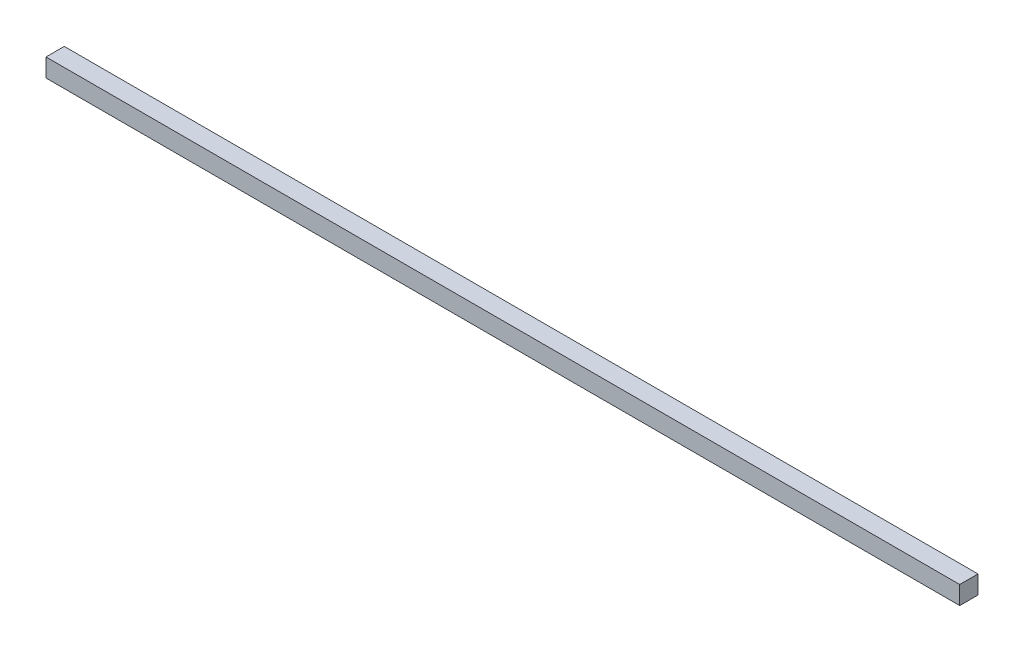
SolidWorks part; units mm, degrees
ref_plane "正面" through (0, 0, 0) normal (1, 0, 0) x (0, 1, 0)
ref_plane "平面" through (0, 0, 0) normal (0, 0, 1) x (0, 1, 0)
ref_plane "右側面" through (0, 0, 0) normal (0, 1, 0) x (-1, 0, 0)
sketch "ｽｹｯﾁ1" plane through (0, 0, 0) normal (1, 0, 0) x (0, 1, 0)
  line L1 (-5, 5) -> (5, 5)
  line L2 (-5, 5) -> (-5, -5)
  line L3 (-5, -5) -> (5, -5)
  line L4 (5, 5) -> (5, -5)
  line L5 (-5, 5) -> (5, -5) construction
  line L6 (-5, -5) -> (5, 5) construction
  point P0 (0, 0)
  dimension "D1" = 10
  dimension "D2" = 10
extrude "ﾎﾞｽ - 押し出し1" add sketch "ｽｹｯﾁ1" along normal blind 500
